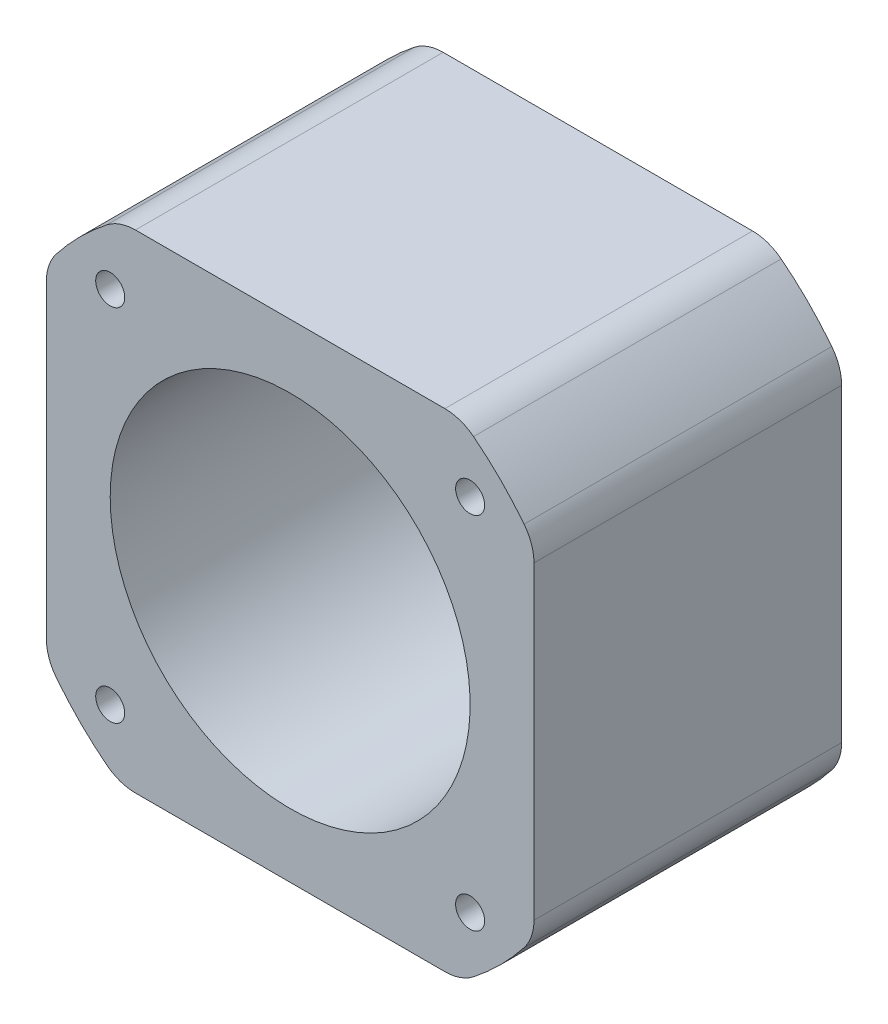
SolidWorks part; units mm, degrees
ref_plane "Front Plane" through (0, 0, 0) normal (0, 0, 1) x (1, 0, 0)
ref_plane "Top Plane" through (0, 0, 0) normal (0, 1, 0) x (1, 0, 0)
ref_plane "Right Plane" through (0, 0, 0) normal (1, 0, 0) x (0, 0, -1)
ref_plane "Plane1" through (0, 0, 34.2) normal (0, 0, 1) x (1, 0, 0)
sketch "Sketch1" plane through (0, 0, 34.2) normal (0, 0, 1) x (1, 0, 0)
  line L0 (-31.3955, 117.9423) -> (-31.3955, 91.292)
  line L1 (-23.7207, 83.6172) -> (2.9297, 83.6172)
  line L2 (10.6045, 91.292) -> (10.6045, 117.9423)
  line L3 (2.9297, 125.6172) -> (-23.7207, 125.6172)
  circle A0 centre (5.1045, 89.1172) radius 1.25
  circle A1 centre (-25.8955, 120.1172) radius 1.25
  arc A2 (-26.1883, 124.7653) -> (-30.5437, 120.4099) centre (-10.3955, 104.6172) ccw
  arc A3 (-30.5437, 120.4099) -> (-31.3955, 117.9423) centre (-27.3955, 117.9423) ccw
  arc A4 (-31.3955, 91.292) -> (-30.5437, 88.8244) centre (-27.3955, 91.292) ccw
  arc A5 (-30.5437, 88.8244) -> (-26.1883, 84.469) centre (-10.3955, 104.6172) ccw
  arc A6 (-26.1883, 84.469) -> (-23.7207, 83.6172) centre (-23.7207, 87.6172) ccw
  arc A7 (2.9297, 83.6172) -> (5.3973, 84.469) centre (2.9297, 87.6172) ccw
  arc A8 (5.3973, 84.469) -> (9.7526, 88.8244) centre (-10.3955, 104.6172) ccw
  arc A9 (9.7526, 88.8244) -> (10.6045, 91.292) centre (6.6045, 91.292) ccw
  arc A10 (10.6045, 117.9423) -> (9.7526, 120.4099) centre (6.6045, 117.9423) ccw
  arc A11 (9.7526, 120.4099) -> (5.3973, 124.7653) centre (-10.3955, 104.6172) ccw
  arc A12 (5.3973, 124.7653) -> (2.9297, 125.6172) centre (2.9297, 121.6172) ccw
  arc A13 (-23.7207, 125.6172) -> (-26.1883, 124.7653) centre (-23.7207, 121.6172) ccw
  circle A14 centre (-10.3955, 104.6172) radius 15.5
  circle A15 centre (5.1045, 120.1172) radius 1.25
  circle A16 centre (-25.8955, 89.1172) radius 1.25
extrude "Boss-Extrude1" add sketch "Sketch1" against normal blind 26.5
